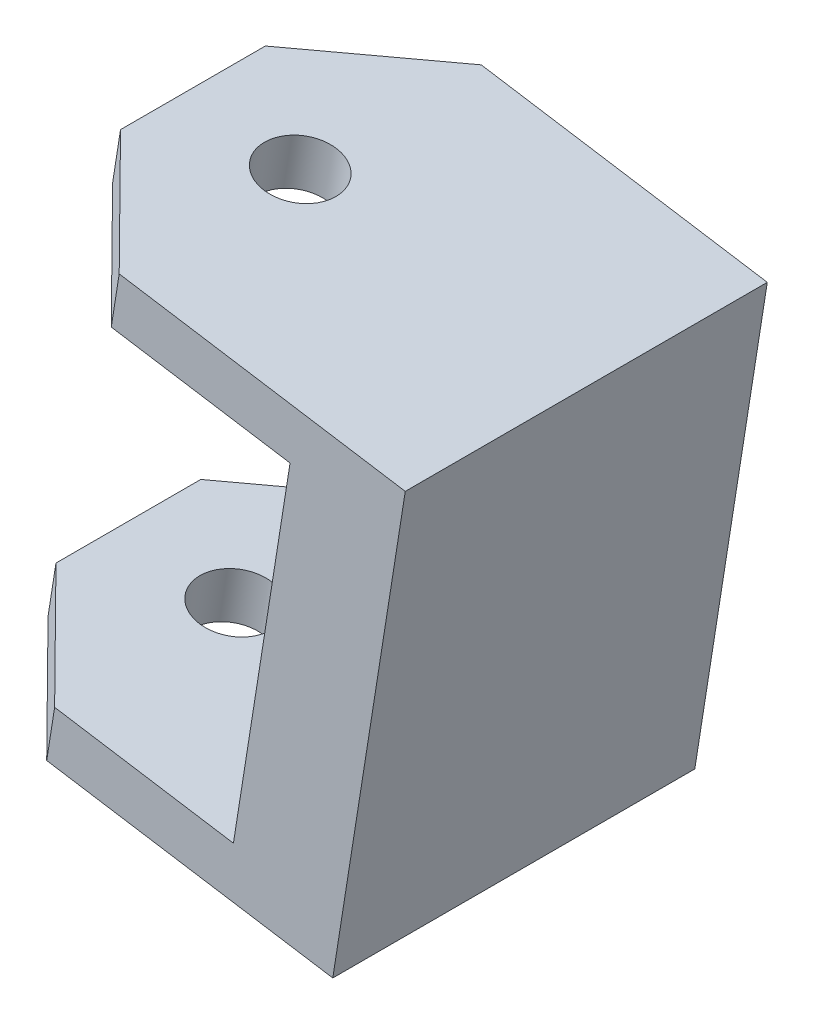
SolidWorks part; units mm, degrees
ref_plane "Plan1" through (0, 0, 0) normal (0, 0, 1) x (1, 0, 0)
ref_plane "Plan2" through (0, 0, 0) normal (0, 1, 0) x (1, 0, 0)
ref_plane "Plan3" through (0, 0, 0) normal (1, 0, 0) x (0, 0, -1)
sketch "Esquisse1" plane through (0, 0, 0) normal (0, 0, 1) x (1, 0, 0)
  line L0 (-295.3078, 52.0891) -> (-320, 56) construction
  line L1 (-320, 56) -> (-323.9109, 31.3078) construction
  line L2 (-320, 56) -> (-316.0891, 80.6922) construction
  line L11 (0, 0) -> (0, 66.8827) construction
  line L12 (-330.9045, 83.0387) -> (-291.3969, 76.7813)
  line L13 (-338.7262, 33.6543) -> (-339.8212, 26.7405)
  line L14 (-299.2187, 27.3969) -> (-338.7262, 33.6543)
  line L15 (-291.3969, 76.7813) -> (-299.2187, 27.3969)
  line L16 (-329.8094, 89.9525) -> (-330.9045, 83.0387)
  line L17 (-275.4866, 81.3486) -> (-329.8094, 89.9525)
  line L18 (-285.4984, 18.1366) -> (-275.4866, 81.3486)
  line L19 (-339.8212, 26.7405) -> (-285.4984, 18.1366)
  dimension "D1" = 40
  dimension "D2" = 56
  dimension "D3" = 320
  dimension "D4" = 55
  dimension "D5" = 64
  dimension "D6" = 40
  dimension "D7" = 50
  dimension "D8" = 9
extrude "Base-Extrusion" add sketch "Esquisse1" against normal mid plane 50
chamfer "Chanfrein1" distance 15 angle 45
sketch "Esquisse2" plane through (5.8274, 36.7929, 0) normal (0.1564, 0.9877, 0) x (-0.9877, 0.1564, 0)
  line L0 (284.8206, 0) -> (339.8206, 0) construction
  line L3 (284.8206, -25) -> (284.8206, 25) construction
  line L4 (339.8206, -10) -> (339.8206, 10) construction
  circle A0 centre (324.8206, 0) radius 5
  dimension "D1" = 10
  dimension "D2" = 40
extrude "Enlèv. mat.-Extru.1" cut sketch "Esquisse2" against normal through all
sketch "Esquisse3" plane through (-281.314, 44.5558, 0) normal (0.9877, -0.1564, 0) x (0, 0, -1)
  line L1 (-25, 37.2515) -> (25, -26.7485) construction
  point P8 (0, 5.2515)
